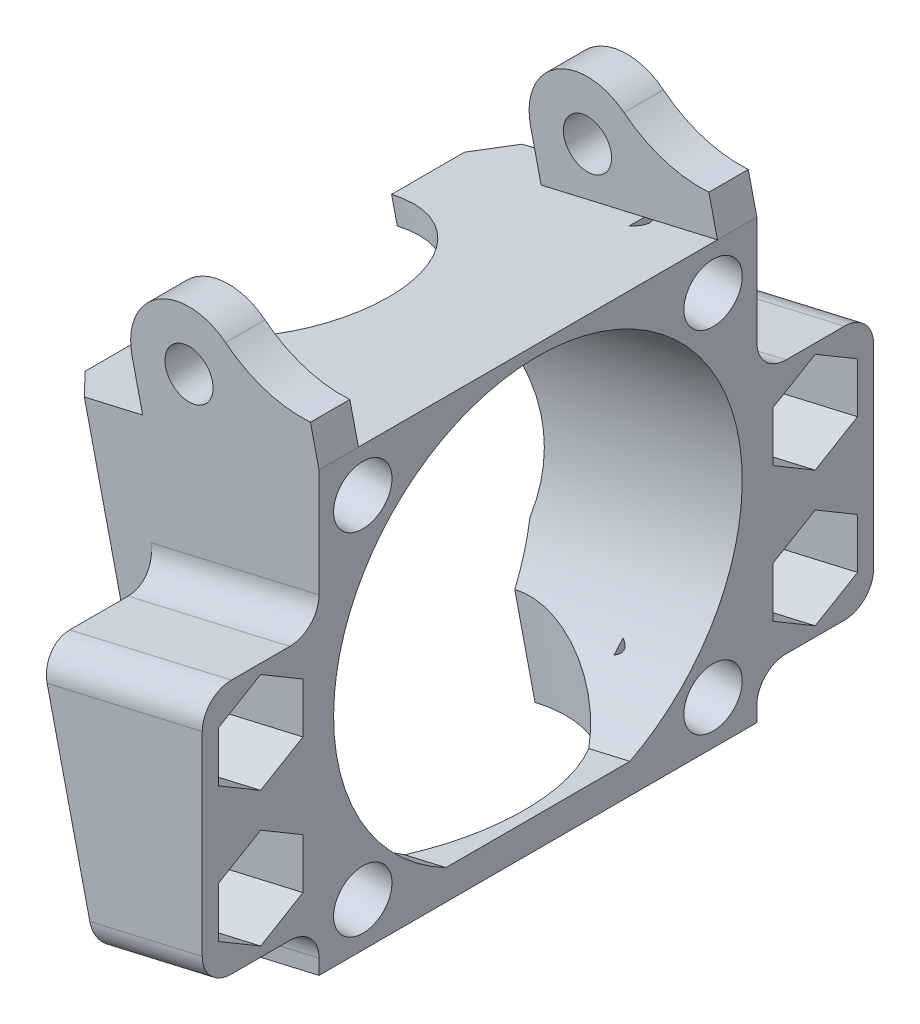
SolidWorks part; units mm, degrees
ref_plane "Спереди" through (0, 0, 0) normal (0, 0, 1) x (1, 0, 0)
ref_plane "Сверху" through (0, 0, 0) normal (0, 1, 0) x (1, 0, 0)
ref_plane "Справа" through (0, 0, 0) normal (1, 0, 0) x (0, 0, -1)
sketch "Эскиз2" plane through (0, 0, 0) normal (0, 0, 1) x (1, 0, 0)
  line L0 (0, 47.2898) -> (0, 0) construction
  line L1 (0, 0) -> (50.8794, 0) construction
  line L2 (0, 0) -> (0, 30)
  line L3 (-11.4503, -2.6435) -> (-18.0258, 25.8384)
  line L4 (-18.0258, 25.8384) -> (0, 30)
  line L6 (-11.4503, -2.6435) -> (0, 0)
  dimension "D1" = 30
  dimension "D2" = 18.5
  dimension "D3" = 13
  dimension "D4" = 90
extrude "Бобышка-Вытянуть1" add sketch "Эскиз2" along normal mid plane 30
sketch "Эскиз3" plane through (-11.4503, -2.6435, 0) normal (-0.9744, -0.225, 0) x (0, 0, 1)
  line L0 (0, 0) -> (0, 36.2635) construction
  line L1 (15, 0) -> (-15, 0) construction
  line L2 (0, 0) -> (0, 29.2311)
  line L3 (0, 29.2311) -> (8, 29.2311)
  line L4 (15, 29.2311) -> (-15, 29.2311) construction
  line L5 (8, 29.2311) -> (8, 27.5)
  line L6 (8, 27.5) -> (11.25, 27.5)
  line L7 (11.25, 27.5) -> (11.25, 0)
  line L8 (11.25, 0) -> (0, 0)
  dimension "D1" = 16
  dimension "D2" = 22.5
  dimension "D3" = 27.5
revolve "Вырез-Повернуть1" cut sketch "Эскиз3" angle 360 about L0
sketch "Эскиз4" plane through (-11.4503, -2.6435, 0) normal (-0.9744, -0.225, 0) x (0, 0, 1)
  line L0 (0, 29.2311) -> (0, -4.9399) construction
  line L1 (8, 29.2311) -> (-8, 29.2311) construction
  line L2 (-11.25, 0) -> (-15, 0) construction
  line L3 (-6.3048, 2) -> (6.3048, 2)
  line L6 (-11.25, 0) -> (11.25, 0) construction
  arc A0 (6.3048, 2) -> (-6.3048, 2) centre (0, 14.5) ccw
  dimension "D1" = 28
  dimension "D2" = 14.5
  dimension "D3" = 2
extrude "Вырез-Вытянуть1" cut sketch "Эскиз4" against normal through all
chamfer "Фаска1" distance 2 angle 45 2 edges at (-14.7381, 11.5975, -15) (-14.7381, 11.5975, 15)
sketch "Эскиз5" plane through (0, 0, 0) normal (1, 0, 0) x (0, 0, -1)
  line L0 (0, 30) -> (0, 0) construction
  line L1 (-15, 30) -> (15, 30) construction
  line L2 (-15, 0) -> (15, 0) construction
  line L3 (-30, 15) -> (0, 15) construction
  circle A0 centre (-12, 27) radius 2
  circle A1 centre (12, 27) radius 2
  circle A2 centre (12, 3) radius 2
  circle A3 centre (-12, 3) radius 2
  dimension "D1" = 4
  dimension "D2" = 24
  dimension "D3" = 24
  dimension "D4" = 15
extrude "Вырез-Вытянуть2" cut sketch "Эскиз5" against normal blind 5
sketch "Эскиз6" plane through (0, 0, 15) normal (0, 0, 1) x (1, 0, 0)
  line L0 (-12.0822, 27.2106) -> (-12.802, 30.3286)
  line L1 (0, 30) -> (-16.0771, 26.2883) construction
  line L2 (0, 30) -> (-0.5849, 32.5334)
  line L3 (-12.0822, 27.2106) -> (0, 30)
  circle A0 centre (-8.9046, 31.2284) radius 1.65
  arc A1 (-6.4043, 34.3507) -> (-12.802, 30.3286) centre (-8.9046, 31.2284) ccw
  arc A2 (-6.4043, 34.3507) -> (-0.5849, 32.5334) centre (-1.1691, 40.8885) ccw
  dimension "D1" = 3.3
  dimension "D2" = 4
  dimension "D4" = 3.2
  dimension "D3" = 8.4
  dimension "D5" = 2.6
extrude "Бобышка-Вытянуть2" add sketch "Эскиз6" against normal blind 2.7
mirror "Зеркальное отражение1" about plane through (0, 0, 0) normal (0, 0, 1) of "Бобышка-Вытянуть2"
ref_plane "Плоскость1" through (-6.5784, -1.5187, 0) normal (-0.9744, -0.225, 0) x (0, 0, 1)
sketch "Эскиз7" plane through (-6.5784, -1.5187, 0) normal (-0.9744, -0.225, 0) x (0, 0, 1)
  line L0 (-15, 20) -> (-23, 20)
  line L1 (-15, 0) -> (-15, 29.2311) construction
  line L2 (-23, 20) -> (-23, 3)
  line L3 (-23, 3) -> (-15, 3)
  line L4 (-15, 3) -> (-15, 20)
  line L5 (0, 0) -> (0, 37.077) construction
  line L6 (15, 3) -> (15, 20)
  line L7 (23, 3) -> (15, 3)
  line L8 (23, 20) -> (23, 3)
  line L9 (15, 20) -> (23, 20)
  dimension "D1" = 3
  dimension "D2" = 8
  dimension "D3" = 17
extrude "Бобышка-Вытянуть3" add sketch "Эскиз7" against normal up to surface (7.4441 mm away)
fillet "Скругление1" radius 2 8 edges at (-5.5387, 19.2474, -23) (-3.6266, 2.2416, -23) (-5.5387, 19.2474, -15) (-3.6266, 2.2416, 23) (-5.5387, 19.2474, 23) (-5.5387, 19.2474, 15) (-3.6266, 2.2416, 15) (-3.6266, 2.2416, -15)
sketch "Эскиз8" plane through (-6.5784, -1.5187, 0) normal (-0.9744, -0.225, 0) x (0, 0, 1)
  line L0 (-19, 17) -> (-19, 3) construction
  line L2 (-21, 3) -> (-17, 3) construction
  line L3 (-23, 11.5) -> (23.7428, 11.5) construction
  line L4 (-23, 18) -> (-23, 5) construction
  line L5 (0, 0) -> (0, 34.8212) construction
  circle A0 centre (-19, 16) radius 1.65
  circle A1 centre (-19, 7) radius 1.65
  circle A2 centre (19, 7) radius 1.65
  circle A3 centre (19, 16) radius 1.65
  dimension "D1" = 3.3
  dimension "D2" = 9
  dimension "D3" = 19
extrude "Вырез-Вытянуть3" cut sketch "Эскиз8" against normal through all
ref_plane "Плоскость2" through (8.0371, 1.8555, 0) normal (-0.9744, -0.225, 0) x (0, 0, 1)
sketch "Эскиз9" plane through (8.0371, 1.8555, 0) normal (-0.9744, -0.225, 0) x (0, 0, 1)
  line L0 (0, 0) -> (0, 22.0449) construction
  line L1 (19, 12.6514) -> (21.9, 14.3257)
  line L2 (21.9, 14.3257) -> (21.9, 17.6743)
  line L3 (21.9, 17.6743) -> (19, 19.3486)
  line L4 (19, 19.3486) -> (16.1, 17.6743)
  line L5 (16.1, 17.6743) -> (16.1, 14.3257)
  line L6 (16.1, 14.3257) -> (19, 12.6514)
  line L7 (19, 10.3486) -> (16.1, 8.6743)
  line L8 (16.1, 8.6743) -> (16.1, 5.3257)
  line L9 (16.1, 5.3257) -> (19, 3.6514)
  line L10 (19, 3.6514) -> (21.9, 5.3257)
  line L11 (21.9, 5.3257) -> (21.9, 8.6743)
  line L12 (21.9, 8.6743) -> (19, 10.3486)
  line L13 (15, 0) -> (-15, 0) construction
  line L14 (-21.9, 8.6743) -> (-19, 10.3486)
  line L15 (-21.9, 5.3257) -> (-21.9, 8.6743)
  line L16 (-19, 3.6514) -> (-21.9, 5.3257)
  line L17 (-16.1, 5.3257) -> (-19, 3.6514)
  line L18 (-16.1, 8.6743) -> (-16.1, 5.3257)
  line L19 (-19, 10.3486) -> (-16.1, 8.6743)
  line L20 (-16.1, 14.3257) -> (-19, 12.6514)
  line L21 (-16.1, 17.6743) -> (-16.1, 14.3257)
  line L22 (-19, 19.3486) -> (-16.1, 17.6743)
  line L23 (-21.9, 17.6743) -> (-19, 19.3486)
  line L24 (-21.9, 14.3257) -> (-21.9, 17.6743)
  line L25 (-19, 12.6514) -> (-21.9, 14.3257)
  circle A0 centre (19, 16) radius 2.9 construction
  circle A1 centre (19, 7) radius 2.9 construction
  circle A2 centre (-19, 7) radius 2.9 construction
  circle A3 centre (-19, 16) radius 2.9 construction
  dimension "D1" = 5.8
extrude "Вырез-Вытянуть4" cut sketch "Эскиз9" along normal blind 13
